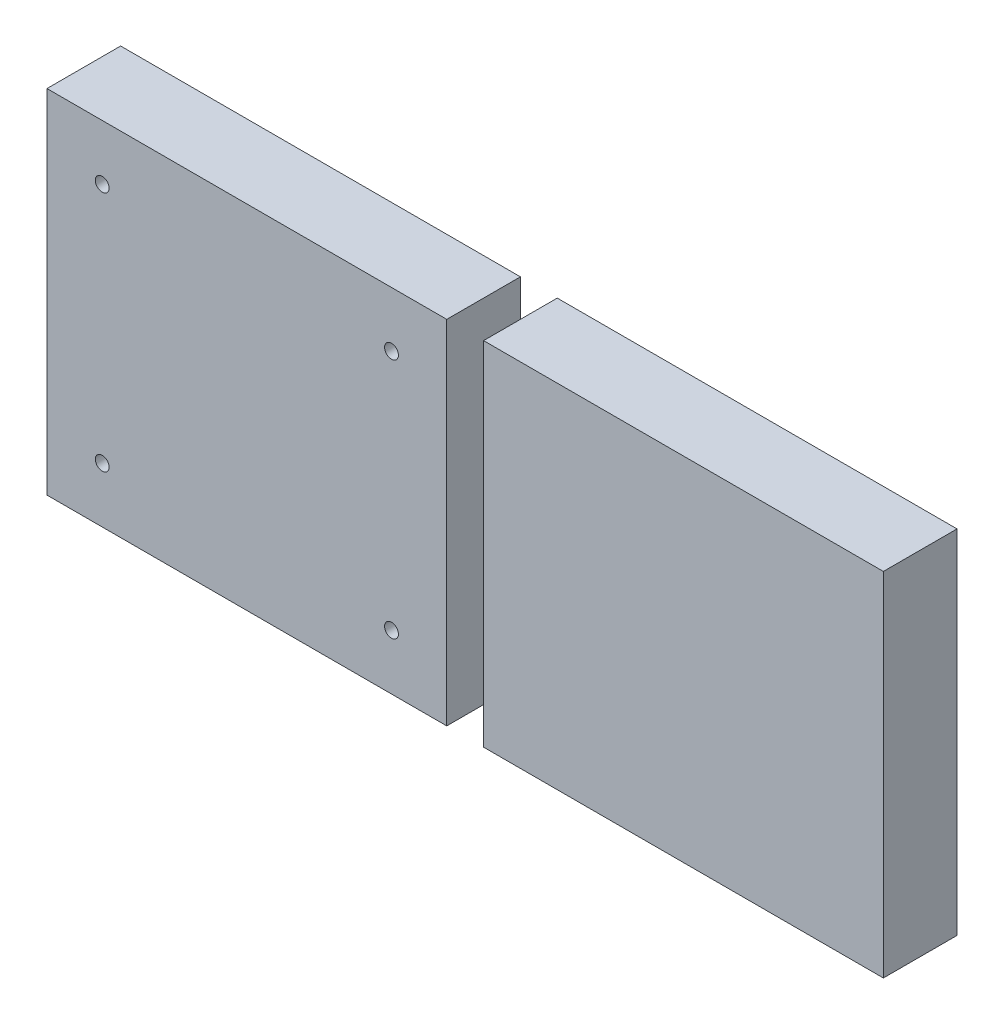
SolidWorks part; units mm, degrees
ref_plane "Front Plane" through (0, 0, 0) normal (0, 0, 1) x (1, 0, 0)
ref_plane "Top Plane" through (0, 0, 0) normal (0, 1, 0) x (1, 0, 0)
ref_plane "Right Plane" through (0, 0, 0) normal (1, 0, 0) x (0, 0, -1)
sketch "Sketch11" plane through (0, 0, 0) normal (0, 0, 1) x (1, 0, 0)
  circle A0 centre (0, 0) radius 16
  dimension "D1" = 32
extrude "Boss-Extrude4" add sketch "Sketch11" along normal blind 8
sketch "Sketch12" plane through (0, 0, 8) normal (0, 0, 1) x (1, 0, 0)
  circle A1 centre (0, 0) radius 6.25
  point P3 (0, 5)
  dimension "D2" = 12.5
extrude "Cut-Extrude10" cut sketch "Sketch12" against normal through all
sketch "Sketch13" plane through (0, 0, 8) normal (0, 0, 1) x (1, 0, 0)
  line L0 (0, 0) -> (0, 20.7745) construction
  line L1 (-0.2199, 13.6) -> (0.2199, 13.6)
  arc A2 (0.5184, 13.8707) -> (2.08, 16.88) centre (5.0567, 13.4256) cw
  arc A3 (-0.5184, 13.8707) -> (-2.08, 16.88) centre (-5.0567, 13.4256) ccw
  arc A4 (-2.08, 16.88) -> (2.08, 16.88) centre (0, -0.9994) cw
  arc A5 (0.5184, 13.8707) -> (0.2199, 13.6) centre (0.2199, 13.9) cw
  arc A6 (-0.2199, 13.6) -> (-0.5184, 13.8707) centre (-0.2199, 13.9) cw
  point P9 (0, 13.6)
  point P14 (0.5, 13.6)
  point P17 (-0.5, 13.6)
  dimension "D5" = 4.56
  dimension "D6" = 18
  dimension "D7" = 0.3
  dimension "D1" = 0.5
  dimension "D2" = 13.6
  dimension "D3" = 1.58
  dimension "D4" = 3.28
extrude "Cut-Extrude12" cut sketch "Sketch13" against normal through all
pattern_circular "CirPattern4" count 30 over 360 about axis through (0, 0, 0) along (0, 0, 1) of "Cut-Extrude12"
extrude "Boss-Extrude6" add sketch "Sketch15" against normal blind 4
sketch "Sketch15" plane through (0, 0, 8) normal (0, 0, 1) x (1, 0, 0)
  line L1 (-21.707, 19.1184) -> (21.707, 19.1184)
  line L2 (-21.707, 19.1184) -> (-21.707, -19.1184)
  line L3 (-21.707, -19.1184) -> (21.707, -19.1184)
  line L4 (21.707, 19.1184) -> (21.707, -19.1184)
  line L5 (-21.707, 19.1184) -> (21.707, -19.1184) construction
  line L6 (-21.707, -19.1184) -> (21.707, 19.1184) construction
  point P0 (0, 0)
sketch "Sketch17" plane through (0, 0, 4) normal (0, 0, -1) x (-1, 0, 0)
  line L0 (-19.707, 17.1184) -> (-19.707, -17.1184)
  line L1 (-19.707, -17.1184) -> (19.707, -17.1184)
  line L2 (19.707, -17.1184) -> (19.707, 17.1184)
  line L3 (19.707, 17.1184) -> (-19.707, 17.1184)
  line L4 (-21.707, 19.1184) -> (-21.707, -19.1184)
  line L5 (-21.707, -19.1184) -> (21.707, -19.1184)
  line L6 (21.707, -19.1184) -> (21.707, 19.1184)
  line L7 (21.707, 19.1184) -> (-21.707, 19.1184)
  line L8 (-21.707, 19.1184) -> (-21.707, -19.1184)
  line L9 (-21.707, -19.1184) -> (21.707, -19.1184)
  line L10 (21.707, -19.1184) -> (21.707, 19.1184)
  line L11 (21.707, 19.1184) -> (-21.707, 19.1184)
  circle A0 centre (15.707, 13.1184) radius 0.75
  circle A1 centre (15.707, -13.1184) radius 0.75
  circle A2 centre (-15.707, -13.1184) radius 0.75
  circle A3 centre (-15.707, 13.1184) radius 0.75
  dimension "D3" = 4
  dimension "D4" = 4
  dimension "D5" = 1.5
  dimension "D6" = 1.5
  dimension "D7" = 1.5
  dimension "D8" = 1.5
  dimension "D1" = 0
  dimension "D2" = 2
extrude "Boss-Extrude7" add sketch "Sketch17" along normal blind 4 contours L10 L11 L8 L9 L3 L2 L1 L0 | A0 | A1 | A2 | A3
ref_plane "Plane1" through (-23.707, 0, 0) normal (-1, 0, 0) x (0, 0, 1)
mirror "Mirror8" about plane through (-23.707, 0, 0) normal (-1, 0, 0)
sketch "Sketch22" plane through (0, 0, 0) normal (0, 0, -1) x (-1, 0, 0)
  circle A0 centre (31.707, -13.1184) radius 0.75 construction
  circle A1 centre (31.707, 13.1184) radius 0.75
  circle A2 centre (31.707, 13.1184) radius 0.75
  circle A3 centre (63.1211, -13.1184) radius 0.75 construction
  circle A4 centre (63.1211, 13.1184) radius 0.75 construction
  circle A5 centre (31.707, -13.1184) radius 0.75
  circle A6 centre (63.1211, -13.1184) radius 0.75
  circle A7 centre (63.1211, 13.1184) radius 0.75
  dimension "D1" = 0
extrude "Cut-Extrude15" cut sketch "Sketch22" against normal up to vertex
sketch "Sketch23" plane through (0, 17.1184, 0) normal (0, -1, 0) x (1, 0, 0)
  line L0 (-36.8023, 0) -> (-41.8023, 0)
  line L9 (-51.0123, 0) -> (-56.0123, 0)
  line L12 (3.5982, 0) -> (8.5982, 0)
  line L13 (-10.6117, 0) -> (-5.6117, 0)
  arc A4 (-36.8023, 0) -> (-41.8023, 0) centre (-39.3023, 0) ccw
  arc A5 (-56.0123, 0) -> (-51.0123, 0) centre (-53.5123, 0) cw
  arc A6 (8.5982, 0) -> (3.5982, 0) centre (6.0982, 0) ccw
  arc A7 (-10.6117, 0) -> (-5.6117, 0) centre (-8.1117, 0) cw
extrude "Boss-Extrude8" add sketch "Sketch23" along normal up to next
